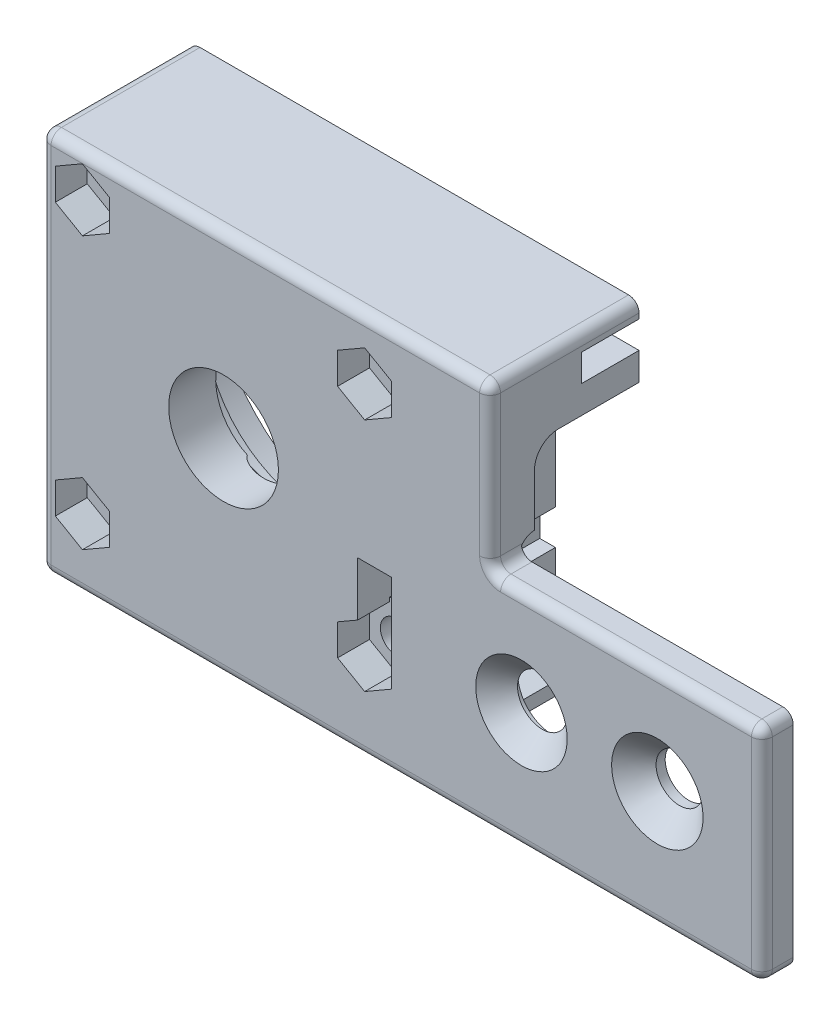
SolidWorks part; units mm, degrees
ref_plane "Front" through (0, 0, 0) normal (0, 0, 1) x (1, 0, 0)
ref_plane "Top" through (0, 0, 0) normal (0, 1, 0) x (1, 0, 0)
ref_plane "Right" through (0, 0, 0) normal (1, 0, 0) x (0, 0, -1)
imported_body "Imported1"
sketch "Sketch1" plane through (-35, 0, 0) normal (-1, 0, 0) x (0, 0, 1)
  line L0 (28.5, 32) -> (28.5, -37.5) construction
  line L1 (28.5, 32) -> (28.5, -37.5)
  line L2 (26.5, -39.5) -> (0, -39.5) construction
  line L3 (26.5, -39.5) -> (0, -39.5)
  point P0 (19, -11.5)
  dimension "D1" = 28
  dimension "D2" = 9.5
hole_wizard "Ø8.6 (8.6) Diameter Hole1" positions "3DSketch2" profile "Sketch3" hole size "Ø8.6" standard "Ansi Metric"
sketch3d "3DSketch2"
  point P0 (-35, -11.5, 19)
sketch "Sketch3" plane through (-35, -11.5, 19) normal (0, 1, 0) x (0, 0, 1)
  line L0 (0, 0) -> (0, 138)
  line L1 (0, 138) -> (2.05, 138)
  line L2 (2.05, 138) -> (2.05, 0)
  line L5 (2.05, 0) -> (0, 0)
  line L11 (0, -6.35) -> (0, 107.95) construction
  dimension "Thru Hole Dia." = 4.1
  dimension "Thru Hole Depth" = 138
